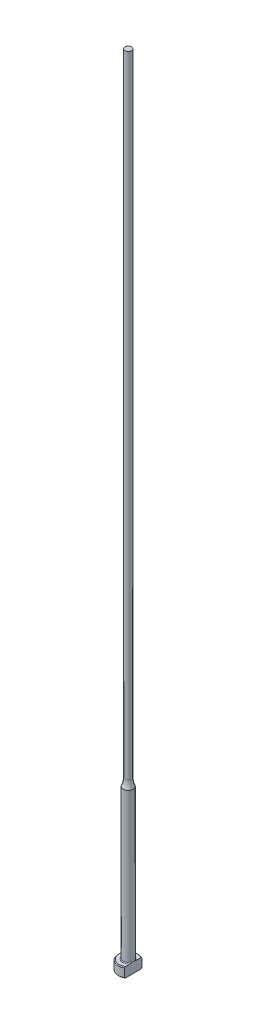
SolidWorks part; units mm, degrees
ref_plane "Front Plane" through (0, 0, 0) normal (0, 0, 1) x (1, 0, 0)
ref_plane "Top Plane" through (0, 0, 0) normal (0, 1, 0) x (1, 0, 0)
ref_plane "Right Plane" through (0, 0, 0) normal (1, 0, 0) x (0, 0, -1)
sketch "Sketch1" plane through (0, 0, 0) normal (0, 0, 1) x (1, 0, 0)
  line L0 (0, 259.9588) -> (0, -15.1925) construction
  line L1 (0, 0) -> (-3.175, 0)
  line L2 (-3.175, 0) -> (-3.175, 3.175)
  line L3 (-3.175, 3.175) -> (-1.5875, 3.175)
  line L4 (-1.0554, 53.3446) -> (-1.0554, 254)
  line L5 (-1.0554, 254) -> (0, 254)
  line L6 (0, 254) -> (0, 0)
  line L7 (-1.5875, 3.175) -> (-1.5875, 50.8)
  arc A0 (-1.5875, 50.8) -> (-1.0554, 53.3446) centre (-7.4054, 53.3446) ccw
  point P13 (-1.5875, 0)
  dimension "D1" = 6.35
  dimension "L" = 254
  dimension "D2" = 3.175
  dimension "H" = 6.35
  dimension "T" = 3.175
  dimension "D" = 2.1107
  dimension "S" = 50.8
revolve "Revolve1" add sketch "Sketch1" angle 360 about L0
chamfer "Chamfer1" distance 0.254 angle 45 2 edges at (0, 3.175, 3.175) (0, 0, 3.175)
fillet "Fillet1" radius 0.254 1 edges at (0, 3.175, 1.5875)
sketch "Sketch2" plane through (0, 0, 0) normal (0, 1, 0) x (1, 0, 0)
  line L0 (1.5875, -2.7496) -> (1.5875, 2.7496)
  circle A0 centre (0, 0) radius 3.175 construction
  arc A2 (1.5875, -2.7496) -> (1.5875, 2.7496) centre (0, 0) ccw
  circle A3 centre (0, 0) radius 3.175 construction
  circle A4 centre (0, 0) radius 1.5875 construction
extrude "Key Head" cut sketch "Sketch2" along normal up to next
